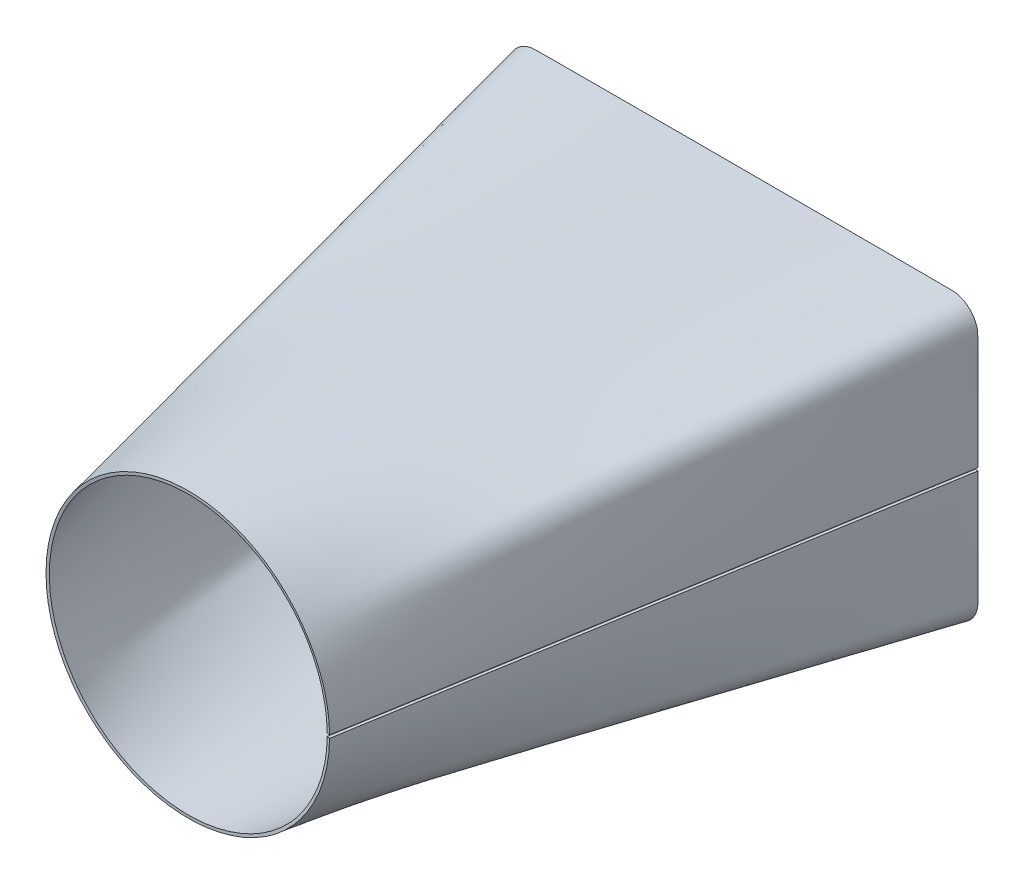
SolidWorks part; units mm, degrees
ref_plane "Plane1" through (0, 0, 0) normal (0, 0, 1) x (1, 0, 0)
ref_plane "Plane2" through (0, 0, 0) normal (0, 1, 0) x (1, 0, 0)
ref_plane "Plane3" through (0, 0, 0) normal (1, 0, 0) x (0, 0, -1)
sketch "ClipBoard" plane through (0, 0, 0) normal (1, 0, 0) x (0, 0, -1)
  line L0 (0, 0) -> (1.5875, 0) construction
  line L1 (0, 0) -> (0, 1.5875) construction
sketch "Inlet" plane through (0, 0, 0) normal (0, 0, 1) x (1, 0, 0)
  line L0 (0, 0) -> (107.95, 0) construction
  line L1 (-114.3, 76.2) -> (114.3, 76.2)
  line L2 (-127, 63.5) -> (-127, -63.5)
  line L3 (-114.3, -76.2) -> (114.3, -76.2)
  line L4 (127, 63.5) -> (127, 0.7937)
  line L5 (0, -0.7937) -> (134.62, -0.7937) construction
  line L6 (0, 0.7937) -> (134.62, 0.7937) construction
  line L7 (127, -0.7937) -> (127, -63.5)
  arc A0 (-127, 63.5) -> (-114.3, 76.2) centre (-114.3, 63.5) cw
  arc A1 (-114.3, -76.2) -> (-127, -63.5) centre (-114.3, -63.5) cw
  arc A2 (127, -63.5) -> (114.3, -76.2) centre (114.3, -63.5) cw
  arc A3 (114.3, 76.2) -> (127, 63.5) centre (114.3, 63.5) cw
  point P4 (0, 76.2)
  point P8 (-127, 76.2)
  point P13 (127, -76.2)
  point P16 (127, 76.2)
ref_plane "Exit Plane" through (0, 0, 304.8) normal (0, 0, 1) x (1, 0, 0)
sketch "Outlet" plane through (0, 0, 304.8) normal (0, 0, 1) x (1, 0, 0)
  line L0 (0, 0.7937) -> (134.62, 0.7937) construction
  line L1 (0, -0.7937) -> (134.62, -0.7937) construction
  line L2 (0, 0.7937) -> (134.62, 0.7937) construction
  line L3 (0, -0.7937) -> (134.62, -0.7937) construction
  arc A0 (76.1959, 0.7937) -> (76.1959, -0.7937) centre (0, 0) ccw
  dimension "Diameter" = 152.4
sheet metal parameters "Sheet-Metal1" thickness 1.5875 parameters "D1"=0.1524
lofted bend "Transition" parameters "D1"=0, "Thickness"=1.5875, "D12"=1
other "Freeform Bend1" parameters "D1"=1000, "D4"=57.296, "D5"=1
flat pattern "Flat-Pattern1"
sketch "Bend-Lines1" plane through (0, 0, 0) normal (0, 1, 0) x (-1, 0, 0)
other "Flatten-<Freeform Bend1>1"
equation "\"Gap@ClipBoard\" = \"Thickness@ClipBoard\" * 1.0"
equation "\"HalfLength@Inlet\" = \"Lenth@Inlet\" / 2"
equation "\"HalfWidth@Inlet\" = \"Width@Inlet\" / 2"
equation "\"HalfGap@Inlet\" = \"Gap@ClipBoard\" / 2"
equation "\"Thickness@Transition\" = \"Thickness@ClipBoard\""
